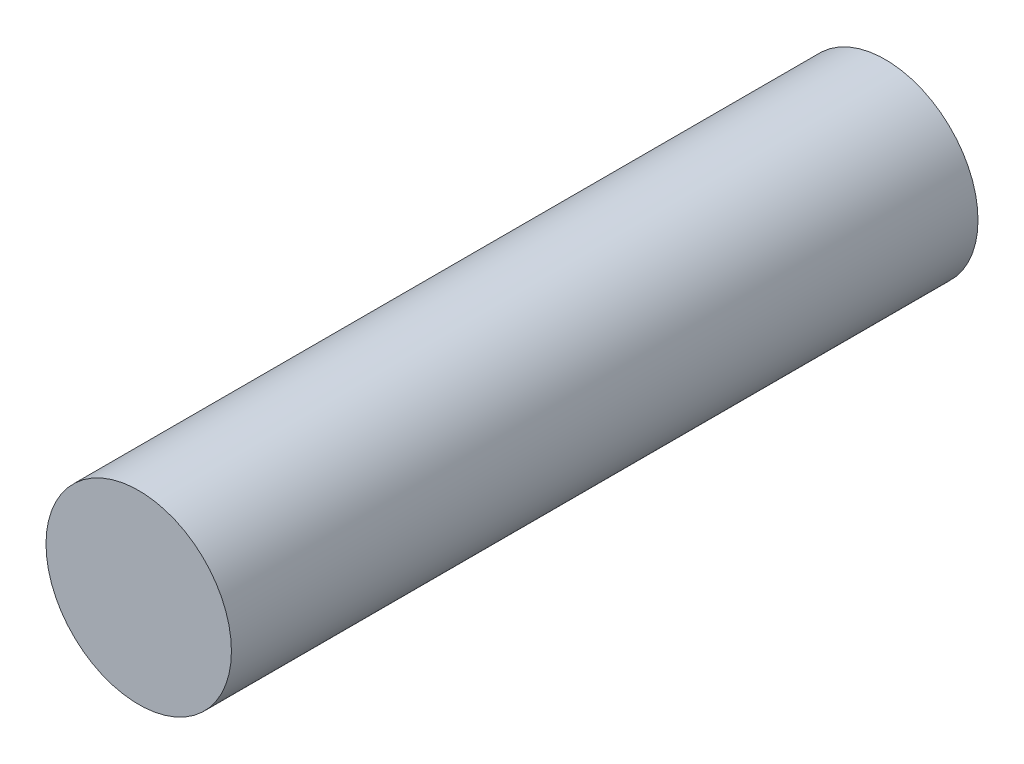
SolidWorks part; units mm, degrees
ref_plane "Front Plane" through (0, 0, 0) normal (0, 0, 1) x (1, 0, 0)
ref_plane "Top Plane" through (0, 0, 0) normal (0, 1, 0) x (1, 0, 0)
ref_plane "Right Plane" through (0, 0, 0) normal (1, 0, 0) x (0, 0, -1)
sketch "Sketch1" plane through (0, 0, 0) normal (0, 0, 1) x (1, 0, 0)
  circle A0 centre (0, 0) radius 38
  dimension "D1" = 76
extrude "Boss-Extrude1" add sketch "Sketch1" along normal mid plane 306
